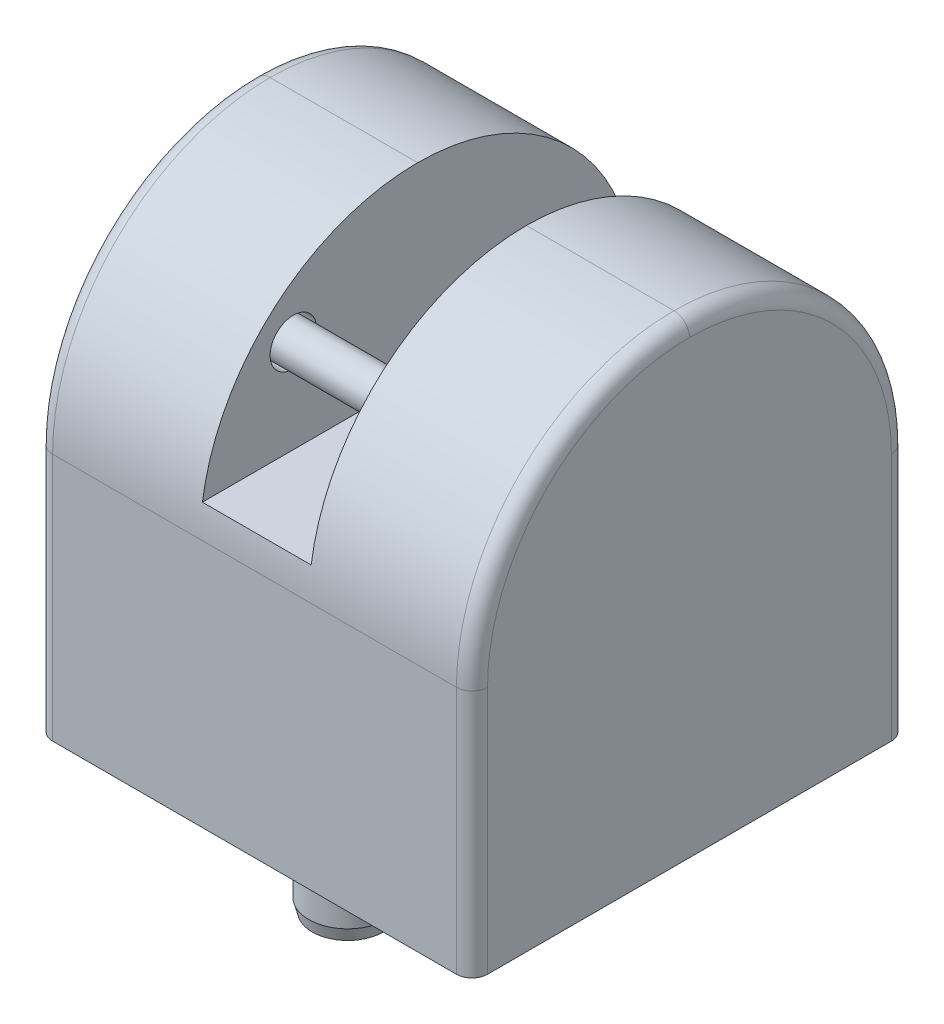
SolidWorks part; units mm, degrees
ref_plane "Front Plane" through (0, 0, 0) normal (0, 0, 1) x (1, 0, 0)
ref_plane "Top Plane" through (0, 0, 0) normal (0, 1, 0) x (1, 0, 0)
ref_plane "Right Plane" through (0, 0, 0) normal (1, 0, 0) x (0, 0, -1)
imported_body "Stock-V1-1"
imported_body "Stock-V1-2"
imported_body "Stock-V1-3"
imported_body "Stock-V1-4"
move or copy body "Body-Move/Copy1" bodies to move or copy 104 101 102 103 copy no rotation origin (149, 0, -246) rotation axis (0, 1, 0) rotation angle 180
